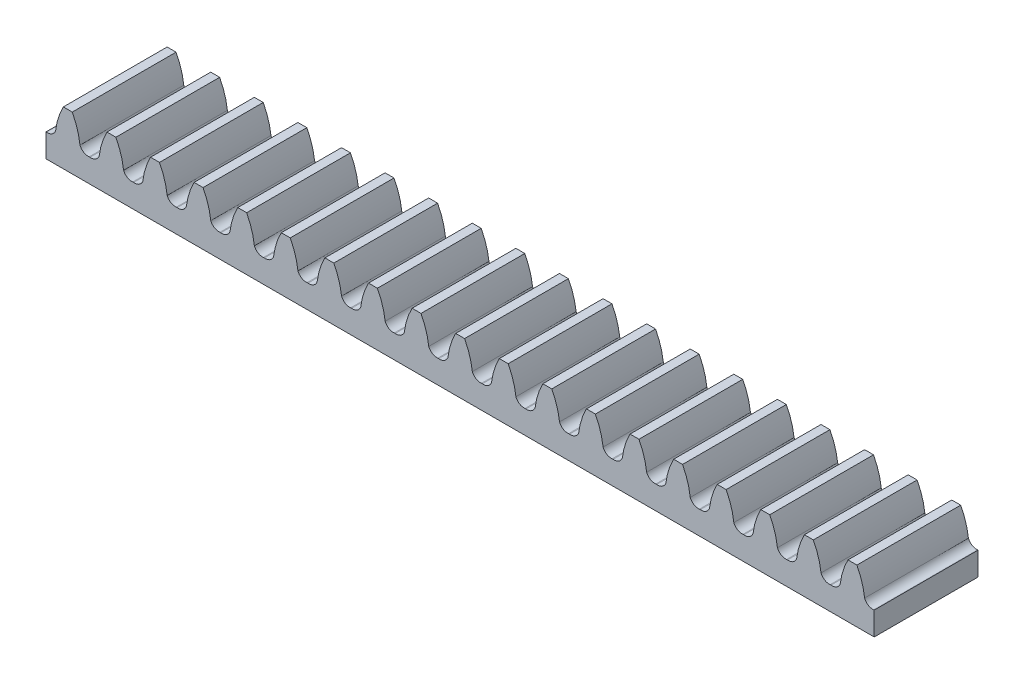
SolidWorks part; units mm, degrees
ref_plane "Ebene vorne" through (0, 0, 0) normal (0, 0, 1) x (1, 0, 0)
ref_plane "Ebene oben" through (0, 0, 0) normal (0, 1, 0) x (1, 0, 0)
ref_plane "Ebene rechts" through (0, 0, 0) normal (1, 0, 0) x (0, 0, -1)
sketch "Skizze1" plane through (0, 0, 0) normal (0, 0, 1) x (1, 0, 0)
  line L0 (8.4, 0) -> (8.4, -30.2169) construction
  line L1 (0, 0) -> (8.4, 0)
  line L2 (0, 0) -> (0, 9)
  line L3 (0, 9) -> (319.2, 9) construction
  line L4 (319.2, 0) -> (319.2, 9)
  line L5 (8.4, 0) -> (8.4, 38.1463) construction
  line L6 (-61.8569, 20.69) -> (90.3038, 20.69) construction
  line L7 (8.4, 20.69) -> (8.4, 0) construction
  line L8 (0.1728, 9) -> (0, 9)
  line L9 (16.6272, 9) -> (16.8, 9)
  line L10 (16.9728, 9) -> (16.8, 9)
  line L11 (33.4272, 9) -> (33.6, 9)
  line L12 (33.7728, 9) -> (33.6, 9)
  line L13 (50.2272, 9) -> (50.4, 9)
  line L14 (50.5728, 9) -> (50.4, 9)
  line L15 (67.0272, 9) -> (67.2, 9)
  line L16 (67.3728, 9) -> (67.2, 9)
  line L17 (83.8272, 9) -> (84, 9)
  line L18 (84.1728, 9) -> (84, 9)
  line L19 (100.6272, 9) -> (100.8, 9)
  line L20 (100.9728, 9) -> (100.8, 9)
  line L21 (117.4272, 9) -> (117.6, 9)
  line L22 (117.7728, 9) -> (117.6, 9)
  line L23 (134.2272, 9) -> (134.4, 9)
  line L24 (134.5728, 9) -> (134.4, 9)
  line L25 (151.0272, 9) -> (151.2, 9)
  line L26 (151.3728, 9) -> (151.2, 9)
  line L27 (167.8272, 9) -> (168, 9)
  line L28 (168.1728, 9) -> (168, 9)
  line L29 (184.6272, 9) -> (184.8, 9)
  line L30 (184.9728, 9) -> (184.8, 9)
  line L31 (201.4272, 9) -> (201.6, 9)
  line L32 (201.7728, 9) -> (201.6, 9)
  line L33 (218.2272, 9) -> (218.4, 9)
  line L34 (218.5728, 9) -> (218.4, 9)
  line L35 (235.0272, 9) -> (235.2, 9)
  line L36 (235.3728, 9) -> (235.2, 9)
  line L37 (251.8272, 9) -> (252, 9)
  line L38 (252.1728, 9) -> (252, 9)
  line L39 (268.6272, 9) -> (268.8, 9)
  line L40 (268.9728, 9) -> (268.8, 9)
  line L41 (285.4272, 9) -> (285.6, 9)
  line L42 (285.7728, 9) -> (285.6, 9)
  line L43 (302.2272, 9) -> (302.4, 9)
  line L44 (302.5728, 9) -> (302.4, 9)
  line L45 (319.0272, 9) -> (319.2, 9)
  line L46 (319.2, 0) -> (8.4, 0)
  arc A0 (10.1222, 20.6709) -> (13.1101, 11.1342) centre (-13.83, 7.93) cw
  arc A1 (10.1222, 20.6709) -> (6.6778, 20.6709) centre (8.4, -56.81) ccw
  arc A2 (0.1728, 9) -> (3.6899, 11.1342) centre (0.54, 12.36) ccw
  arc A3 (16.6272, 9) -> (13.1101, 11.1342) centre (16.26, 12.36) cw
  arc A4 (6.6778, 20.6709) -> (3.6899, 11.1342) centre (30.63, 7.93) ccw
  arc A5 (16.9728, 9) -> (20.4899, 11.1342) centre (17.34, 12.36) ccw
  arc A6 (23.4778, 20.6709) -> (20.4899, 11.1342) centre (47.43, 7.93) ccw
  arc A7 (26.9222, 20.6709) -> (23.4778, 20.6709) centre (25.2, -56.81) ccw
  arc A8 (26.9222, 20.6709) -> (29.9101, 11.1342) centre (2.97, 7.93) cw
  arc A9 (33.4272, 9) -> (29.9101, 11.1342) centre (33.06, 12.36) cw
  arc A10 (33.7728, 9) -> (37.2899, 11.1342) centre (34.14, 12.36) ccw
  arc A11 (40.2778, 20.6709) -> (37.2899, 11.1342) centre (64.23, 7.93) ccw
  arc A12 (43.7222, 20.6709) -> (40.2778, 20.6709) centre (42, -56.81) ccw
  arc A13 (43.7222, 20.6709) -> (46.7101, 11.1342) centre (19.77, 7.93) cw
  arc A14 (50.2272, 9) -> (46.7101, 11.1342) centre (49.86, 12.36) cw
  arc A15 (50.5728, 9) -> (54.0899, 11.1342) centre (50.94, 12.36) ccw
  arc A16 (57.0778, 20.6709) -> (54.0899, 11.1342) centre (81.03, 7.93) ccw
  arc A17 (60.5222, 20.6709) -> (57.0778, 20.6709) centre (58.8, -56.81) ccw
  arc A18 (60.5222, 20.6709) -> (63.5101, 11.1342) centre (36.57, 7.93) cw
  arc A19 (67.0272, 9) -> (63.5101, 11.1342) centre (66.66, 12.36) cw
  arc A20 (67.3728, 9) -> (70.8899, 11.1342) centre (67.74, 12.36) ccw
  arc A21 (73.8778, 20.6709) -> (70.8899, 11.1342) centre (97.83, 7.93) ccw
  arc A22 (77.3222, 20.6709) -> (73.8778, 20.6709) centre (75.6, -56.81) ccw
  arc A23 (77.3222, 20.6709) -> (80.3101, 11.1342) centre (53.37, 7.93) cw
  arc A24 (83.8272, 9) -> (80.3101, 11.1342) centre (83.46, 12.36) cw
  arc A25 (84.1728, 9) -> (87.6899, 11.1342) centre (84.54, 12.36) ccw
  arc A26 (90.6778, 20.6709) -> (87.6899, 11.1342) centre (114.63, 7.93) ccw
  arc A27 (94.1222, 20.6709) -> (90.6778, 20.6709) centre (92.4, -56.81) ccw
  arc A28 (94.1222, 20.6709) -> (97.1101, 11.1342) centre (70.17, 7.93) cw
  arc A29 (100.6272, 9) -> (97.1101, 11.1342) centre (100.26, 12.36) cw
  arc A30 (100.9728, 9) -> (104.4899, 11.1342) centre (101.34, 12.36) ccw
  arc A31 (107.4778, 20.6709) -> (104.4899, 11.1342) centre (131.43, 7.93) ccw
  arc A32 (110.9222, 20.6709) -> (107.4778, 20.6709) centre (109.2, -56.81) ccw
  arc A33 (110.9222, 20.6709) -> (113.9101, 11.1342) centre (86.97, 7.93) cw
  arc A34 (117.4272, 9) -> (113.9101, 11.1342) centre (117.06, 12.36) cw
  arc A35 (117.7728, 9) -> (121.2899, 11.1342) centre (118.14, 12.36) ccw
  arc A36 (124.2778, 20.6709) -> (121.2899, 11.1342) centre (148.23, 7.93) ccw
  arc A37 (127.7222, 20.6709) -> (124.2778, 20.6709) centre (126, -56.81) ccw
  arc A38 (127.7222, 20.6709) -> (130.7101, 11.1342) centre (103.77, 7.93) cw
  arc A39 (134.2272, 9) -> (130.7101, 11.1342) centre (133.86, 12.36) cw
  arc A40 (134.5728, 9) -> (138.0899, 11.1342) centre (134.94, 12.36) ccw
  arc A41 (141.0778, 20.6709) -> (138.0899, 11.1342) centre (165.03, 7.93) ccw
  arc A42 (144.5222, 20.6709) -> (141.0778, 20.6709) centre (142.8, -56.81) ccw
  arc A43 (144.5222, 20.6709) -> (147.5101, 11.1342) centre (120.57, 7.93) cw
  arc A44 (151.0272, 9) -> (147.5101, 11.1342) centre (150.66, 12.36) cw
  arc A45 (151.3728, 9) -> (154.8899, 11.1342) centre (151.74, 12.36) ccw
  arc A46 (157.8778, 20.6709) -> (154.8899, 11.1342) centre (181.83, 7.93) ccw
  arc A47 (161.3222, 20.6709) -> (157.8778, 20.6709) centre (159.6, -56.81) ccw
  arc A48 (161.3222, 20.6709) -> (164.3101, 11.1342) centre (137.37, 7.93) cw
  arc A49 (167.8272, 9) -> (164.3101, 11.1342) centre (167.46, 12.36) cw
  arc A50 (168.1728, 9) -> (171.6899, 11.1342) centre (168.54, 12.36) ccw
  arc A51 (174.6778, 20.6709) -> (171.6899, 11.1342) centre (198.63, 7.93) ccw
  arc A52 (178.1222, 20.6709) -> (174.6778, 20.6709) centre (176.4, -56.81) ccw
  arc A53 (178.1222, 20.6709) -> (181.1101, 11.1342) centre (154.17, 7.93) cw
  arc A54 (184.6272, 9) -> (181.1101, 11.1342) centre (184.26, 12.36) cw
  arc A55 (184.9728, 9) -> (188.4899, 11.1342) centre (185.34, 12.36) ccw
  arc A56 (191.4778, 20.6709) -> (188.4899, 11.1342) centre (215.43, 7.93) ccw
  arc A57 (194.9222, 20.6709) -> (191.4778, 20.6709) centre (193.2, -56.81) ccw
  arc A58 (194.9222, 20.6709) -> (197.9101, 11.1342) centre (170.97, 7.93) cw
  arc A59 (201.4272, 9) -> (197.9101, 11.1342) centre (201.06, 12.36) cw
  arc A60 (201.7728, 9) -> (205.2899, 11.1342) centre (202.14, 12.36) ccw
  arc A61 (208.2778, 20.6709) -> (205.2899, 11.1342) centre (232.23, 7.93) ccw
  arc A62 (211.7222, 20.6709) -> (208.2778, 20.6709) centre (210, -56.81) ccw
  arc A63 (211.7222, 20.6709) -> (214.7101, 11.1342) centre (187.77, 7.93) cw
  arc A64 (218.2272, 9) -> (214.7101, 11.1342) centre (217.86, 12.36) cw
  arc A65 (218.5728, 9) -> (222.0899, 11.1342) centre (218.94, 12.36) ccw
  arc A66 (225.0778, 20.6709) -> (222.0899, 11.1342) centre (249.03, 7.93) ccw
  arc A67 (228.5222, 20.6709) -> (225.0778, 20.6709) centre (226.8, -56.81) ccw
  arc A68 (228.5222, 20.6709) -> (231.5101, 11.1342) centre (204.57, 7.93) cw
  arc A69 (235.0272, 9) -> (231.5101, 11.1342) centre (234.66, 12.36) cw
  arc A70 (235.3728, 9) -> (238.8899, 11.1342) centre (235.74, 12.36) ccw
  arc A71 (241.8778, 20.6709) -> (238.8899, 11.1342) centre (265.83, 7.93) ccw
  arc A72 (245.3222, 20.6709) -> (241.8778, 20.6709) centre (243.6, -56.81) ccw
  arc A73 (245.3222, 20.6709) -> (248.3101, 11.1342) centre (221.37, 7.93) cw
  arc A74 (251.8272, 9) -> (248.3101, 11.1342) centre (251.46, 12.36) cw
  arc A75 (252.1728, 9) -> (255.6899, 11.1342) centre (252.54, 12.36) ccw
  arc A76 (258.6778, 20.6709) -> (255.6899, 11.1342) centre (282.63, 7.93) ccw
  arc A77 (262.1222, 20.6709) -> (258.6778, 20.6709) centre (260.4, -56.81) ccw
  arc A78 (262.1222, 20.6709) -> (265.1101, 11.1342) centre (238.17, 7.93) cw
  arc A79 (268.6272, 9) -> (265.1101, 11.1342) centre (268.26, 12.36) cw
  arc A80 (268.9728, 9) -> (272.4899, 11.1342) centre (269.34, 12.36) ccw
  arc A81 (275.4778, 20.6709) -> (272.4899, 11.1342) centre (299.43, 7.93) ccw
  arc A82 (278.9222, 20.6709) -> (275.4778, 20.6709) centre (277.2, -56.81) ccw
  arc A83 (278.9222, 20.6709) -> (281.9101, 11.1342) centre (254.97, 7.93) cw
  arc A84 (285.4272, 9) -> (281.9101, 11.1342) centre (285.06, 12.36) cw
  arc A85 (285.7728, 9) -> (289.2899, 11.1342) centre (286.14, 12.36) ccw
  arc A86 (292.2778, 20.6709) -> (289.2899, 11.1342) centre (316.23, 7.93) ccw
  arc A87 (295.7222, 20.6709) -> (292.2778, 20.6709) centre (294, -56.81) ccw
  arc A88 (295.7222, 20.6709) -> (298.7101, 11.1342) centre (271.77, 7.93) cw
  arc A89 (302.2272, 9) -> (298.7101, 11.1342) centre (301.86, 12.36) cw
  arc A90 (302.5728, 9) -> (306.0899, 11.1342) centre (302.94, 12.36) ccw
  arc A91 (309.0778, 20.6709) -> (306.0899, 11.1342) centre (333.03, 7.93) ccw
  arc A92 (312.5222, 20.6709) -> (309.0778, 20.6709) centre (310.8, -56.81) ccw
  arc A93 (312.5222, 20.6709) -> (315.5101, 11.1342) centre (288.57, 7.93) cw
  arc A94 (319.0272, 9) -> (315.5101, 11.1342) centre (318.66, 12.36) cw
  dimension "D3" = 77.5
  dimension "D7" = 27.13
  dimension "D8" = 56.81
  dimension "D10" = 12.36
  dimension "D11" = 3.38
  dimension "D13" = 77.5
  dimension "D1" = 319.2
  dimension "D2" = 9
  dimension "D4" = 7.93
  dimension "D5" = 30.63
  dimension "D6" = 19
  dimension "D9" = 0.54
  dimension "D12" = 8.4
  dimension "D14" = 16.8
extrude "Aufsatz-Linear austragen1" add sketch "Skizze1" along normal blind 40 contours A1 A4 A2 L8 L2 L1 L7
